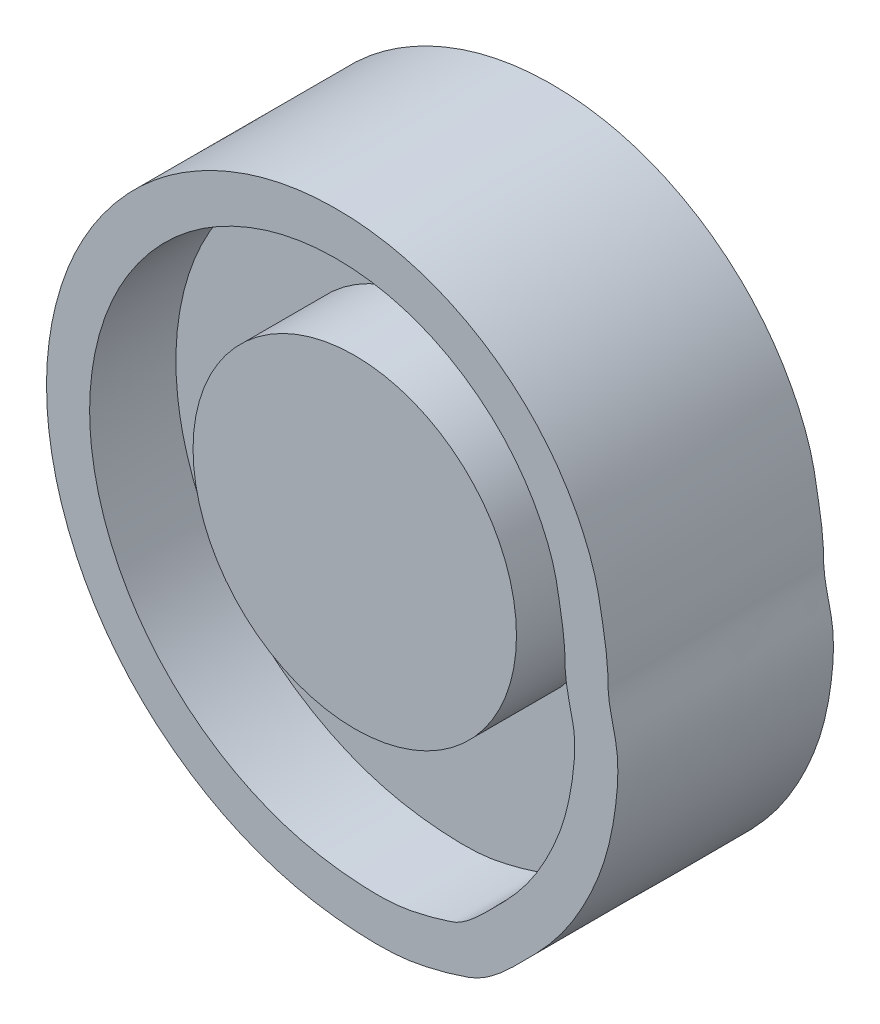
SolidWorks part; units mm, degrees
ref_plane "Face" through (0, 0, 0) normal (0, 0, 1) x (1, 0, 0)
ref_plane "Dessus" through (0, 0, 0) normal (0, 1, 0) x (1, 0, 0)
ref_plane "Droite" through (0, 0, 0) normal (1, 0, 0) x (0, 0, -1)
sketch "Esquisse2" plane through (0, 0, 0) normal (0, 0, 1) x (1, 0, 0)
  circle A0 centre (0, 0) radius 23.5
  dimension "D1" = 47
curve "Courbe3"
curve "Courbe4"
curve "Courbe5"
sketch "Esquisse3" plane through (0, 0, 0) normal (0, 1, 0) x (1, 0, 0)
  line L0 (23.5, 0) -> (23.5, -20)
  dimension "D1" = 20
  dimension "D2" = 23.5
loft "Base-Lissage" add
sketch "Esquisse5" plane through (0, 0, 20) normal (0, 0, 1) x (1, 0, 0)
  circle A0 centre (0, 0) radius 15
  point P4 (-24.4272, -4.544)
  dimension "D1" = 30
  dimension "D2" = 4
extrude "Enlèv. mat.-Extru.2" cut sketch "Esquisse5" against normal blind 8
sketch "Esquisse7" plane through (0, 0, 0) normal (0, 0, -1) x (-1, 0, 0)
  circle A0 centre (0, 0) radius 15
  point P4 (24.4272, -4.544)
  dimension "D1" = 30
  dimension "D2" = 4
extrude "Enlèv. mat.-Extru.3" cut sketch "Esquisse7" against normal blind 8
sketch "Esquisse8" plane through (0, 0, 20) normal (0, 0, 1) x (1, 0, 0)
  line L0 (0, -33.1329) -> (0, 22.2696) construction
  line L1 (5.4697, -31.0201) -> (-5.4697, 31.0201) construction
  point P6 (23.5, 0)
  dimension "D1" = 10
ref_plane "Plan1" through (0, 0, 0) normal (-0.9848, -0.1736, 0) x (0, 0, 1)
sketch "Esquisse9" plane through (0, 0, 0) normal (0, 0, -1) x (-1, 0, 0)
  circle A0 centre (0, 0) radius 11
  dimension "D1" = 22
extrude "Enlèv. mat.-Extru.4" cut sketch "Esquisse9" against normal blind 16
